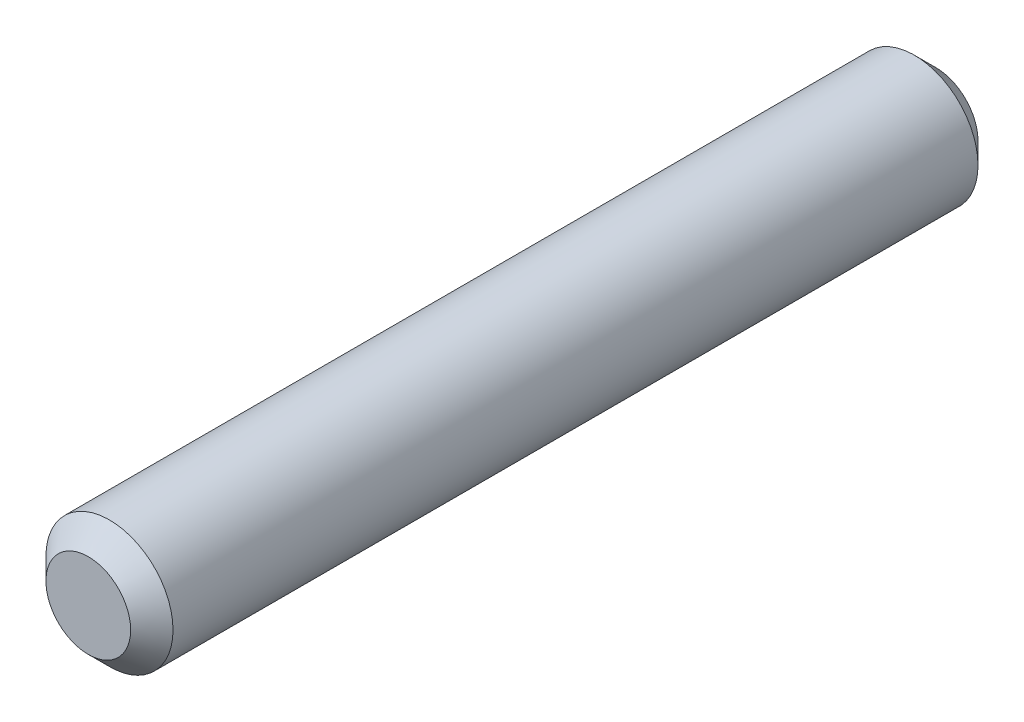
SolidWorks part; units mm, degrees
ref_plane "Plan de face" through (0, 0, 0) normal (0, 0, 1) x (1, 0, 0)
ref_plane "Plan de dessus" through (0, 0, 0) normal (0, 1, 0) x (1, 0, 0)
ref_plane "Plan de droite" through (0, 0, 0) normal (1, 0, 0) x (0, 0, -1)
sketch "Esquisse1" plane through (0, 0, 0) normal (0, 0, 1) x (1, 0, 0)
  circle A0 centre (0, 0) radius 1.5
  dimension "D1" = 3
extrude "Extrusion1" add sketch "Esquisse1" along normal mid plane 20
chamfer "Chanfrein2" distance 0.5 angle 45 1 edges at (1.5, 0, -10)
chamfer "Chanfrein3" distance 0.5 angle 45 1 edges at (1.5, 0, 10)
